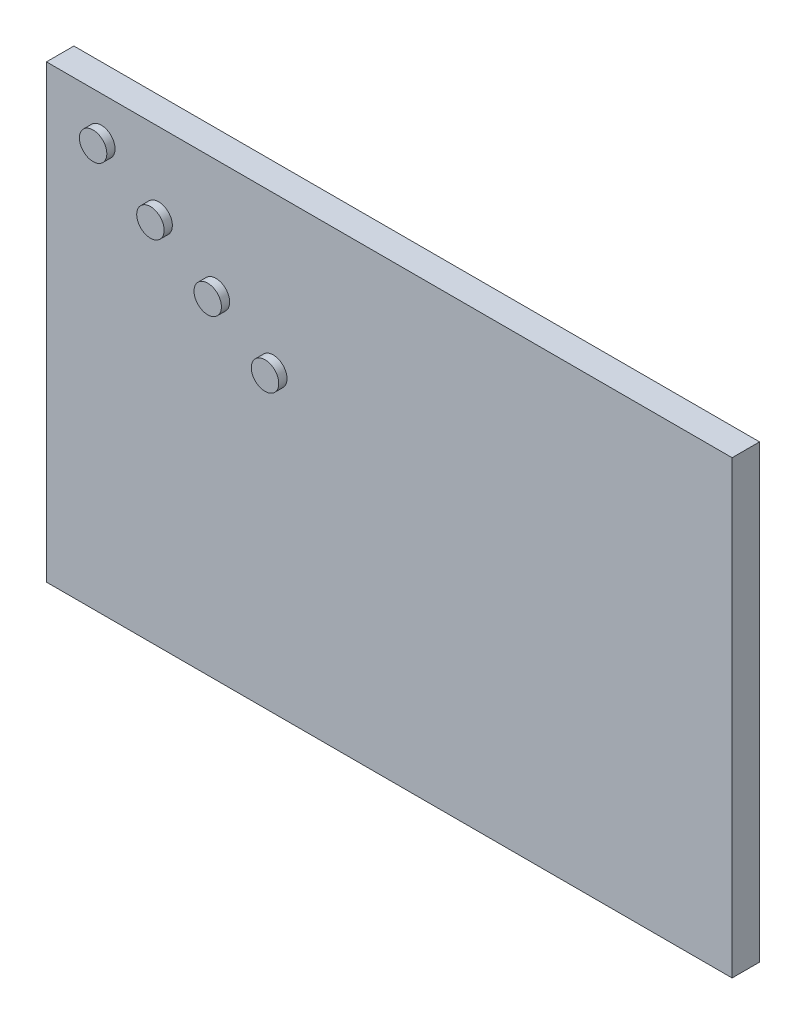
SolidWorks part; units mm, degrees
ref_plane "Ebene vorne" through (0, 0, 0) normal (0, 0, 1) x (1, 0, 0)
ref_plane "Ebene oben" through (0, 0, 0) normal (0, 1, 0) x (1, 0, 0)
ref_plane "Ebene rechts" through (0, 0, 0) normal (1, 0, 0) x (0, 0, -1)
sketch "Skizze1" plane through (0, 0, 0) normal (0, 0, 1) x (1, 0, 0)
  line L1 (0, 0) -> (2499.3163, 0)
  line L2 (0, 0) -> (0, 1642.4963)
  line L3 (0, 1642.4963) -> (2499.3163, 1642.4963)
  line L4 (2499.3163, 0) -> (2499.3163, 1642.4963)
extrude "Linear austragen1" add sketch "Skizze1" against normal blind 100
sketch "Skizze2" plane through (0, 0, 0) normal (0, 0, 1) x (1, 0, 0)
  line L1 (0, 0) -> (0, 1642.4963) construction
  line L3 (0, 1642.4963) -> (2499.3163, 1642.4963) construction
  circle A0 centre (200, 1492.4963) radius 50
  dimension "D3" = 100
  dimension "x" = 200
  dimension "y" = 150
extrude "Linear austragen2" add sketch "Skizze2" along normal blind 30 separate body
pattern_linear "Lineares Muster1" count 4 spacing 250 along (0.8357, -0.5492, 0) of "Linear austragen2"
equation "\"x\"=200"
equation "\"y\"=150"
equation "\"D3@Lineares Muster1\" =  sqr( \"x\"*\"x\" + \"y\"*\"y\" ) "
